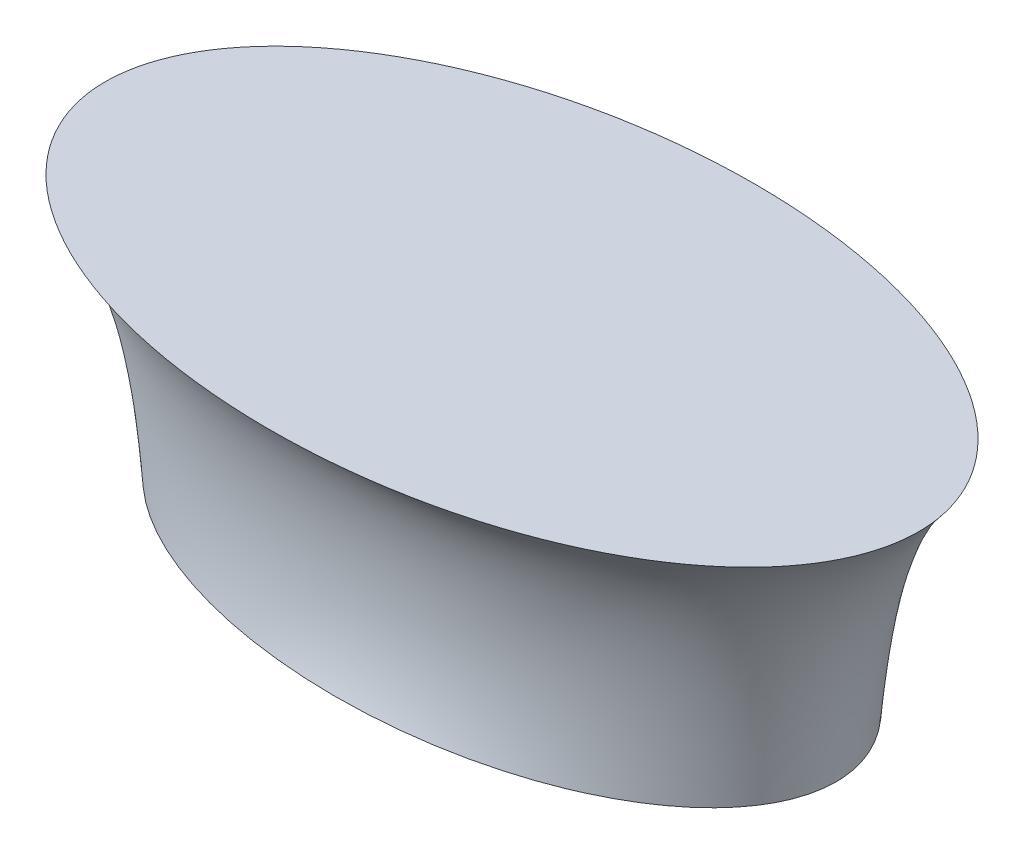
SolidWorks part; units mm, degrees
ref_plane "Ebene vorne" through (0, 0, 0) normal (0, 0, 1) x (1, 0, 0)
ref_plane "Ebene oben" through (0, 0, 0) normal (0, 1, 0) x (1, 0, 0)
ref_plane "Ebene rechts" through (0, 0, 0) normal (1, 0, 0) x (0, 0, -1)
sketch "Skizze1" plane through (0, 0, 0) normal (0, 1, 0) x (1, 0, 0)
  ellipse E0 centre (0, 0) end of major axis (55.6802, 0) minor radius 30.3235
ref_plane "Ebene1" through (0, 42.8382, 0) normal (0, 1, 0) x (-1, 0, 0)
sketch "Skizze2" plane through (0, 42.8382, 0) normal (0, 1, 0) x (-1, 0, 0)
  ellipse E0 centre (0, 0) end of major axis (68.3832, 2.1648) minor radius 39.06
sketch "Skizze3" plane through (0, 0, 0) normal (1, 0, 0) x (0, 0, -1)
  line L0 (0, 0) -> (0, 17.5014) construction
  spline S0 degree 3 poles (-39.0405, 42.8382) (-25.7735, 34.1971) (-24.6349, 13.6387) (-30.3235, 0) knots 0 0 0 0 1 1 1 1
  spline S1 degree 3 poles (39.0405, 42.8382) (25.7735, 34.1971) (24.6349, 13.6387) (30.3235, 0) knots 0 0 0 0 1 1 1 1
sketch "Skizze4" plane through (0, 0, 0) normal (0, 0, 1) x (1, 0, 0)
  line L0 (0, 0) -> (0, 42.8382) construction
  line L1 (68.3944, 42.8382) -> (-68.3944, 42.8382) construction
  spline S0 degree 3 poles (68.3832, 42.8382) (58.2817, 30.9689) (56.9457, 14.8047) (55.6802, 0) knots 0 0 0 0 1 1 1 1
  spline S1 degree 3 poles (-68.3832, 42.8382) (-58.2817, 30.9689) (-56.9457, 14.8047) (-55.6802, 0) knots 0 0 0 0 1 1 1 1
loft "Ausformung1" add profiles "Skizze1", "Skizze2"
